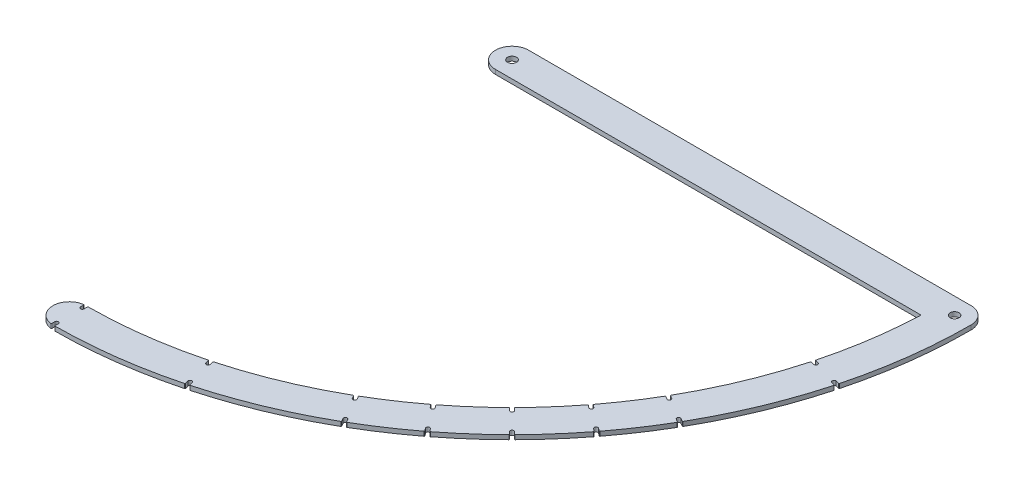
SolidWorks part; units mm, degrees
ref_plane "Piano frontale" through (0, 0, 0) normal (0, 0, 1) x (1, 0, 0)
ref_plane "Piano superiore" through (0, 0, 0) normal (0, 1, 0) x (1, 0, 0)
ref_plane "Piano destro" through (0, 0, 0) normal (1, 0, 0) x (0, 0, -1)
sketch "Schizzo2" plane through (0, 0, 0) normal (0, 1, 0) x (1, 0, 0)
  line L282 (1854.3117, 1925.3701) -> (2254.3117, 1925.3701)
  line L283 (1854.3117, 1895.3701) -> (2239.0193, 1895.3701)
  line L340 (2146.4863, 1620.4583) -> (2148.535, 1618.4095)
  line L341 (2144.2235, 1618.1956) -> (2146.2723, 1616.1468)
  line L342 (2127.8225, 1634.5966) -> (2125.7659, 1636.6532)
  line L343 (2130.0852, 1636.8593) -> (2128.0286, 1638.9159)
  line L345 (2181.8278, 1661.075) -> (2184.1264, 1659.3111)
  line L346 (2179.8797, 1658.5362) -> (2182.1784, 1656.7724)
  line L347 (2161.4782, 1672.6562) -> (2159.1708, 1674.4267)
  line L348 (2163.4263, 1675.1949) -> (2161.1189, 1676.9655)
  line L350 (2211.5654, 1705.9571) -> (2214.0746, 1704.5084)
  line L351 (2209.9654, 1703.1859) -> (2212.4746, 1701.7372)
  line L352 (2189.8783, 1714.7831) -> (2187.3595, 1716.2374)
  line L353 (2191.4783, 1717.5544) -> (2188.9595, 1719.0086)
  line L355 (2252.2982, 1805.3864) -> (2255.0969, 1804.6365)
  line L356 (2251.47, 1802.2955) -> (2254.2687, 1801.5456)
  line L357 (2229.0658, 1808.2986) -> (2226.2564, 1809.0514)
  line L358 (2229.894, 1811.3896) -> (2227.0846, 1812.1424)
  line L360 (2103.6068, 1582.8541) -> (2105.3707, 1580.5554)
  line L361 (2106.1456, 1584.8021) -> (2107.9094, 1582.5034)
  line L362 (2092.0256, 1603.2036) -> (2090.2551, 1605.511)
  line L363 (2089.4869, 1601.2555) -> (2087.7163, 1603.563)
  line L365 (2058.7247, 1553.1164) -> (2060.1734, 1550.6072)
  line L366 (2061.4959, 1554.7164) -> (2062.9446, 1552.2072)
  line L367 (2049.8987, 1574.8035) -> (2048.4444, 1577.3223)
  line L368 (2047.1274, 1573.2035) -> (2045.6732, 1575.7223)
  line L370 (1959.2954, 1512.3836) -> (1960.0453, 1509.5849)
  line L371 (1962.3864, 1513.2118) -> (1963.1363, 1510.4131)
  line L372 (1956.3832, 1535.616) -> (1955.6304, 1538.4254)
  line L373 (1953.2922, 1534.7878) -> (1952.5394, 1537.5972)
  line L375 (1852.7117, 1498.7729) -> (1852.7117, 1496.023)
  line L376 (1855.9117, 1498.7729) -> (1855.9117, 1495.8755)
  line L377 (1855.9117, 1521.9674) -> (1855.9117, 1524.8759)
  line L378 (1852.7117, 1521.9674) -> (1852.7117, 1524.7173)
  arc A0 (1856.4142, 1495.3755) -> (1959.6893, 1508.9719) centre (1854.3117, 1910.3701) ccw
  arc A1 (1963.7511, 1510.0603) -> (2059.9881, 1549.923) centre (1854.3117, 1910.3701) ccw
  arc A2 (2063.6298, 1552.0255) -> (2105.2764, 1579.8528) centre (1854.3117, 1910.3701) ccw
  arc A3 (2108.6125, 1582.4127) -> (2146.2705, 1615.4379) centre (1854.3117, 1910.3701) ccw
  arc A4 (2149.2439, 1618.4113) -> (2182.2691, 1656.0693) centre (1854.3117, 1910.3701) ccw
  arc A5 (2184.829, 1659.4055) -> (2212.6563, 1701.052) centre (1854.3117, 1910.3701) ccw
  arc A6 (2214.7589, 1704.6937) -> (2254.6216, 1800.9307) centre (1854.3117, 1910.3701) ccw
  arc A7 (2255.7099, 1804.9925) -> (2269.3117, 1910.3701) centre (1854.3117, 1910.3701) ccw
  arc A8 (1856.4089, 1525.3759) -> (1951.9297, 1537.9514) centre (1854.3117, 1910.3701) ccw
  arc A9 (1955.9813, 1539.037) -> (2044.9925, 1575.9067) centre (1854.3117, 1910.3701) ccw
  arc A10 (2048.6251, 1578.004) -> (2087.0174, 1603.6569) centre (1854.3117, 1910.3701) ccw
  arc A11 (2090.3452, 1606.2104) -> (2125.0607, 1636.6551) centre (1854.3117, 1910.3701) ccw
  arc A12 (2128.0267, 1639.6211) -> (2158.4714, 1674.3366) centre (1854.3117, 1910.3701) ccw
  arc A13 (2161.0249, 1677.6644) -> (2186.6779, 1716.0567) centre (1854.3117, 1910.3701) ccw
  arc A14 (2188.7751, 1719.6893) -> (2225.6448, 1808.7005) centre (1854.3117, 1910.3701) ccw
  arc A15 (2226.7304, 1812.7521) -> (2239.0193, 1895.3701) centre (1854.3117, 1910.3701) ccw
  circle A16 centre (2254.3117, 1910.3701) radius 4
  circle A17 centre (2254.3117, 1910.3701) radius 4
  arc A18 (2269.3117, 1910.3701) -> (2254.3117, 1925.3701) centre (2254.3117, 1910.3701) ccw
  arc A19 (1852.1392, 1525.212) -> (1852.1392, 1495.5283) centre (1854.3117, 1510.3701) ccw
  arc A20 (1852.7117, 1524.7173) -> (1852.1392, 1525.212) centre (1852.2117, 1524.7173) ccw
  arc A21 (1852.1392, 1495.5283) -> (1852.7117, 1496.023) centre (1852.2117, 1496.023) ccw
  arc A22 (1854.3117, 1925.3701) -> (1854.3117, 1895.3701) centre (1854.3117, 1910.3701) ccw
  circle A23 centre (1854.3117, 1910.3701) radius 4.05
  arc A24 (2146.4863, 1620.4583) -> (2144.2235, 1618.1956) centre (2145.3549, 1619.3269) ccw
  arc A25 (2127.8225, 1634.5966) -> (2130.0852, 1636.8593) centre (2128.9539, 1635.728) ccw
  arc A26 (2146.2705, 1615.4379) -> (2146.2723, 1616.1468) centre (2145.9187, 1615.7932) ccw
  arc A27 (2148.535, 1618.4095) -> (2149.2439, 1618.4113) centre (2148.8886, 1618.7631) ccw
  arc A28 (2128.0267, 1639.6211) -> (2128.0286, 1638.9159) centre (2128.3822, 1639.2695) ccw
  arc A29 (2125.7659, 1636.6532) -> (2125.0607, 1636.6551) centre (2125.4124, 1636.2996) ccw
  arc A30 (2181.8278, 1661.075) -> (2179.8797, 1658.5362) centre (2180.8537, 1659.8056) ccw
  arc A31 (2161.4782, 1672.6562) -> (2163.4263, 1675.1949) centre (2162.4523, 1673.9256) ccw
  arc A32 (2182.2691, 1656.0693) -> (2182.1784, 1656.7724) centre (2181.874, 1656.3757) ccw
  arc A33 (2184.1264, 1659.3111) -> (2184.829, 1659.4055) centre (2184.4308, 1659.7078) ccw
  arc A34 (2161.0249, 1677.6644) -> (2161.1189, 1676.9655) centre (2161.4232, 1677.3621) ccw
  arc A35 (2159.1708, 1674.4267) -> (2158.4714, 1674.3366) centre (2158.8664, 1674.0301) ccw
  arc A36 (2211.5654, 1705.9571) -> (2209.9654, 1703.1859) centre (2210.7654, 1704.5715) ccw
  arc A37 (2189.8783, 1714.7831) -> (2191.4783, 1717.5544) centre (2190.6783, 1716.1688) ccw
  arc A38 (2212.6563, 1701.052) -> (2212.4746, 1701.7372) centre (2212.2246, 1701.3042) ccw
  arc A39 (2214.0746, 1704.5084) -> (2214.7589, 1704.6937) centre (2214.3246, 1704.9415) ccw
  arc A40 (2188.7751, 1719.6893) -> (2188.9595, 1719.0086) centre (2189.2095, 1719.4417) ccw
  arc A41 (2187.3595, 1716.2374) -> (2186.6779, 1716.0567) centre (2187.1095, 1715.8044) ccw
  arc A42 (2252.2982, 1805.3864) -> (2251.47, 1802.2955) centre (2251.8841, 1803.8409) ccw
  arc A43 (2229.0658, 1808.2986) -> (2229.894, 1811.3896) centre (2229.4799, 1809.8441) ccw
  arc A44 (2254.6216, 1800.9307) -> (2254.2687, 1801.5456) centre (2254.1393, 1801.0626) ccw
  arc A45 (2255.0969, 1804.6365) -> (2255.7099, 1804.9925) centre (2255.2263, 1805.1195) ccw
  arc A46 (2226.7304, 1812.7521) -> (2227.0846, 1812.1424) centre (2227.2141, 1812.6253) ccw
  arc A47 (2226.2564, 1809.0514) -> (2225.6448, 1808.7005) centre (2226.127, 1808.5684) ccw
  arc A48 (2106.1456, 1584.8021) -> (2103.6068, 1582.8541) centre (2104.8762, 1583.8281) ccw
  arc A49 (2089.4869, 1601.2555) -> (2092.0256, 1603.2036) centre (2090.7563, 1602.2296) ccw
  arc A50 (2107.9094, 1582.5034) -> (2108.6125, 1582.4127) centre (2108.3061, 1582.8078) ccw
  arc A51 (2105.2764, 1579.8528) -> (2105.3707, 1580.5554) centre (2104.974, 1580.251) ccw
  arc A52 (2087.7163, 1603.563) -> (2087.0174, 1603.6569) centre (2087.3197, 1603.2586) ccw
  arc A53 (2090.3452, 1606.2104) -> (2090.2551, 1605.511) centre (2090.6517, 1605.8154) ccw
  arc A54 (2061.4959, 1554.7164) -> (2058.7247, 1553.1164) centre (2060.1103, 1553.9164) ccw
  arc A55 (2047.1274, 1573.2035) -> (2049.8987, 1574.8035) centre (2048.5117, 1574.0059) ccw
  arc A56 (2062.9446, 1552.2072) -> (2063.6298, 1552.0255) centre (2063.3777, 1552.4572) ccw
  arc A57 (2059.9881, 1549.923) -> (2060.1734, 1550.6072) centre (2059.7403, 1550.3572) ccw
  arc A58 (2045.6732, 1575.7223) -> (2044.9925, 1575.9067) centre (2045.2401, 1575.4723) ccw
  arc A59 (2048.6251, 1578.004) -> (2048.4444, 1577.3223) centre (2048.8775, 1577.5723) ccw
  arc A60 (1962.3864, 1513.2118) -> (1959.2954, 1512.3836) centre (1960.8409, 1512.7977) ccw
  arc A61 (1953.2922, 1534.7878) -> (1956.3832, 1535.616) centre (1954.837, 1535.2046) ccw
  arc A62 (1963.1363, 1510.4131) -> (1963.7511, 1510.0603) centre (1963.6192, 1510.5426) ccw
  arc A63 (1959.6893, 1508.9719) -> (1960.0453, 1509.5849) centre (1959.5623, 1509.4555) ccw
  arc A64 (1952.5394, 1537.5972) -> (1951.9297, 1537.9514) centre (1952.0565, 1537.4677) ccw
  arc A65 (1955.9813, 1539.037) -> (1955.6304, 1538.4254) centre (1956.1134, 1538.5548) ccw
  arc A66 (1855.9117, 1498.7729) -> (1852.7117, 1498.7729) centre (1854.3117, 1498.7729) ccw
  arc A67 (1852.7117, 1521.9674) -> (1855.9117, 1521.9674) centre (1854.3117, 1521.9701) ccw
  arc A68 (1855.9117, 1495.8755) -> (1856.4142, 1495.3755) centre (1856.4117, 1495.8755) ccw
  arc A69 (1856.4089, 1525.3759) -> (1855.9117, 1524.8759) centre (1856.4117, 1524.8759) ccw
extrude "Estrusione-Estrusione1" add sketch "Schizzo2" along normal blind 4 contours L283 A15 A46 L358 A43 L357 A47 A14 A40 L353 A37 L352 A41 A13 A34 L348 A31 L347 A35 A12 A28 L343 A25 L342 A29 A11 A53 L362 A49 L363 A52 A10 A59 L367 A55 L368 A58 A9 A65 L372 A61 L373 A64 A8 A69 L377 A67 L378 A20 A19 A21 L375 A66 L376 A68 A0 A63 L370 A60 L371 A62 A1 A57 L365 A54 L366 A56 A2 A51 L360 A48 L361 A50 A3 A26 L341 A24 L340 A27 A4 A32 L346 A30 L345 A33 A5 A38 L351 A36 L350 A39 A6 A44 L356 A42 L355 A45 A7 A18 L282 A22 | A23 | A16
move or copy body "Corpo-Sposta/copia1" [suppressed] bodies to move or copy 101
